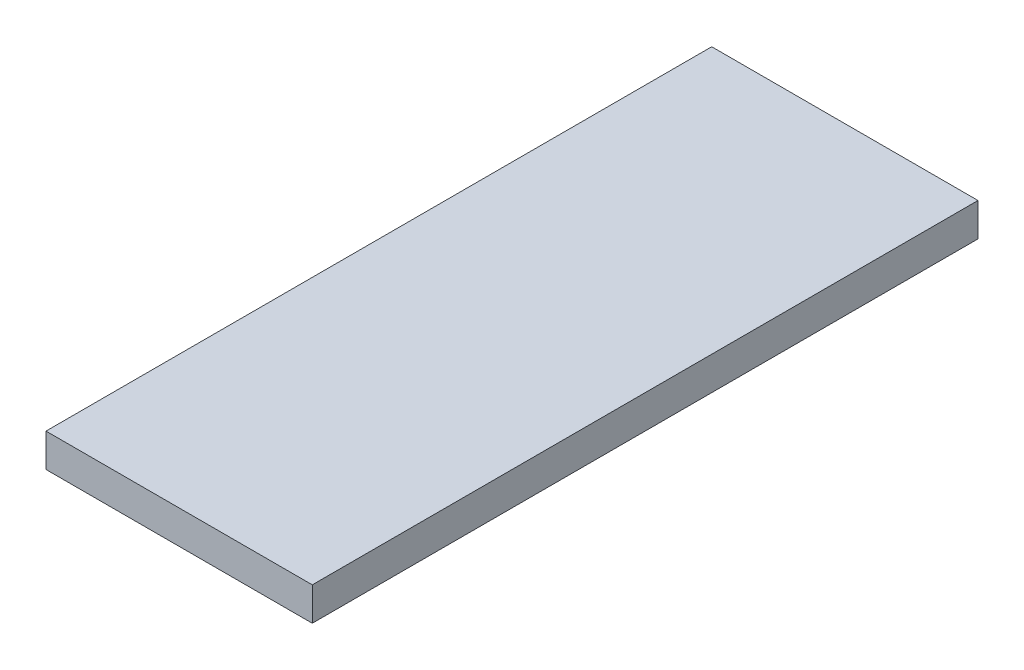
SolidWorks part; units mm, degrees
ref_plane "Vorne" through (0, 0, 0) normal (0, 0, 1) x (1, 0, 0)
ref_plane "Oben" through (0, 0, 0) normal (0, 1, 0) x (1, 0, 0)
ref_plane "Rechts" through (0, 0, 0) normal (1, 0, 0) x (0, 0, -1)
sketch "Skizze1" plane through (0, 0, 0) normal (0, 0, 1) x (1, 0, 0)
  line L0 (-20, -2.5) -> (20, 2.5) construction
  line L1 (-20, 2.5) -> (20, 2.5)
  line L2 (-20, 2.5) -> (-20, -2.5)
  line L3 (-20, -2.5) -> (20, -2.5)
  line L4 (20, 2.5) -> (20, -2.5)
  dimension "D1" = 5
  dimension "D2" = 40
extrude "Linear austragen1" add sketch "Skizze1" along normal mid plane 100
